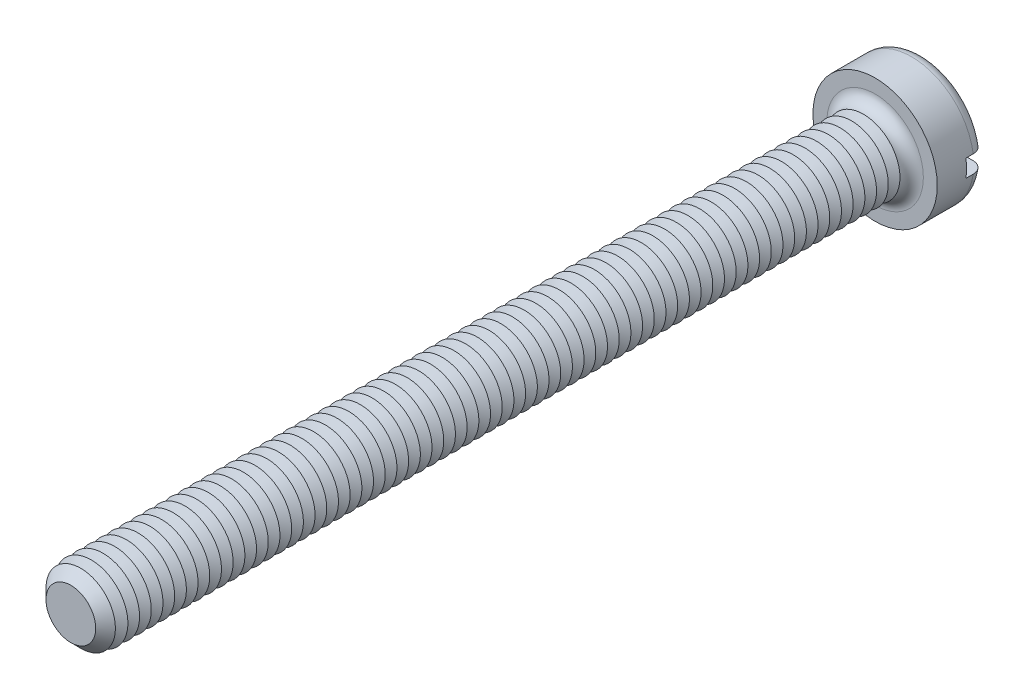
SolidWorks part; units mm, degrees
ref_plane "Front Plane" through (0, 0, 0) normal (0, 0, 1) x (1, 0, 0)
ref_plane "Top Plane" through (0, 0, 0) normal (0, 1, 0) x (1, 0, 0)
ref_plane "Right Plane" through (0, 0, 0) normal (1, 0, 0) x (0, 0, -1)
sketch "Sketch3" plane through (0, 0, 0) normal (0, 0, 1) x (1, 0, 0)
  circle A0 centre (0, 0) radius 4.25
  dimension "D1" = 8.5
extrude "Boss-Extrude2" add sketch "Sketch3" against normal blind 3.3
sketch "Sketch4" plane through (0, 0, 0) normal (0, 0, 1) x (1, 0, 0)
  circle A0 centre (0, 0) radius 2.5
  dimension "D1" = 5
extrude "Boss-Extrude3" add sketch "Sketch4" along normal blind 55
fillet "Fillet1" radius 0.8 2 edges at (4.25, 0, -3.3) (2.5, 0, 0)
chamfer "Chamfer1" distance 0.8 angle 45 1 edges at (2.5, 0, 55)
sketch "Sketch5" plane through (0, 0, 0) normal (1, 0, 0) x (0, 0, -1)
  line L0 (1.6944, 0) -> (-7.6738, 0) construction
sketch "Sketch6" plane through (0, 0, 0) normal (1, 0, 0) x (0, 0, -1)
  line L0 (-0.8, 2.5) -> (-1.2, 1.8072)
  line L1 (-1.2, 1.8072) -> (-1.6, 2.5)
  line L2 (-0.8, 2.5) -> (-54.2, 2.5) construction
  line L3 (-1.6, 2.5) -> (-0.8, 2.5)
  dimension "D1" = 0.8
revolve "Cut-Revolve1" cut sketch "Sketch6" angle 360 about L0
pattern_linear "LPattern1" count 67 spacing 0.8 along (0, 0, 1) of "Cut-Revolve1"
sketch "Sketch8" plane through (0, 0, -3.3) normal (0, 0, -1) x (-1, 0, 0)
  line L1 (4.25, -0.6) -> (-4.25, -0.6)
  line L2 (4.25, -0.6) -> (4.25, 0.6)
  line L3 (4.25, 0.6) -> (-4.25, 0.6)
  line L4 (-4.25, -0.6) -> (-4.25, 0.6)
  line L5 (4.25, -0.6) -> (-4.25, 0.6) construction
  line L6 (4.25, 0.6) -> (-4.25, -0.6) construction
  point P0 (0, 0)
  dimension "D1" = 8.5
  dimension "D2" = 1.2
extrude "Cut-Extrude1" cut sketch "Sketch8" against normal blind 1.3
